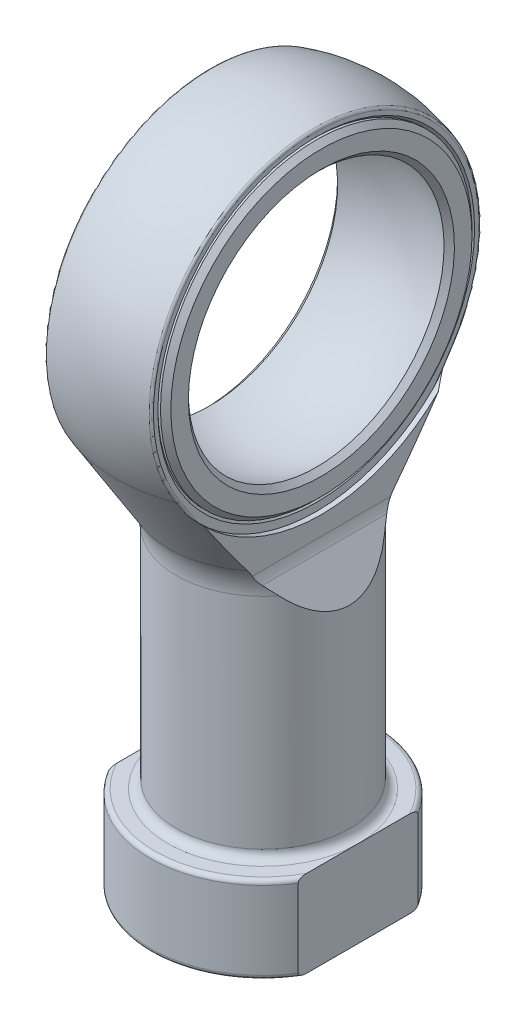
SolidWorks part; units mm, degrees
ref_plane "Plan de face" through (0, 0, 0) normal (0, 0, 1) x (1, 0, 0)
ref_plane "Plan de dessus" through (0, 0, 0) normal (0, 1, 0) x (1, 0, 0)
ref_plane "Plan de droite" through (0, 0, 0) normal (1, 0, 0) x (0, 0, -1)
sketch "Esquisse6" plane through (0, 0, 0) normal (0, 0, 1) x (1, 0, 0)
  line L0 (0, 0) -> (7.0324, 0) construction
  line L1 (-3.075, 9) -> (3.075, 9)
  line L2 (-3.375, 8.7) -> (-3.375, 7.6854)
  line L3 (-3.075, 9) -> (-3.375, 8.7)
  line L4 (3.375, 8.7) -> (3.375, 7.6854)
  line L5 (3.075, 9) -> (3.375, 8.7)
  line L6 (3.375, 7.6854) -> (3.075, 7.3854)
  line L7 (-3.075, 7.3854) -> (-3.375, 7.6854)
  arc A1 (3.075, 7.3854) -> (-3.075, 7.3854) centre (0, 0) ccw
  point P1 (0, 8)
  point P7 (-3.375, 9)
  point P13 (3.375, 9)
  dimension "D1" = 8
  dimension "D2" = 6.75
  dimension "D3" = 9
revolve "Révolution3" add sketch "Esquisse6" angle 360 about L0
sketch "Esquisse2" plane through (0, 0, 0) normal (0, 0, 1) x (1, 0, 0)
  line L0 (0, 10) -> (0, 5)
  line L5 (-5, -11.8435) -> (-5, -24.5)
  line L6 (-5.5, -25) -> (-6.25, -25)
  line L7 (-6.5, -25.25) -> (-6.5, -29.75)
  line L8 (-6.25, -30) -> (-3, -30)
  line L9 (0, -5) -> (0, -13.2679)
  line L10 (-8.5346, -5.2115) -> (-5.4396, -10.2801)
  line L11 (-3, -30) -> (-3, -15)
  line L12 (-3, -15) -> (0, -13.2679)
  arc A0 (-5, -24.5) -> (-5.5, -25) centre (-5.5, -24.5) cw
  arc A1 (0, 10) -> (-8.5346, -5.2115) centre (0, 0) ccw
  arc A2 (-6.5, -29.75) -> (-6.25, -30) centre (-6.25, -29.75) ccw
  arc A3 (-6.25, -25) -> (-6.5, -25.25) centre (-6.25, -25.25) ccw
  arc A4 (-5, -11.8435) -> (-5.4396, -10.2801) centre (-8, -11.8435) ccw
  arc A8 (0, 5) -> (0, -5) centre (0, 0) ccw
  point P7 (-6.5, -30)
  point P17 (-6.5, -25)
  point P20 (-5, -11)
  dimension "D1" = 20
  dimension "D10" = 0.5
  dimension "D11" = 0.25
  dimension "D12" = 3
  dimension "D16" = 5
  dimension "D7" = 15
  dimension "D2" = 11
  dimension "D3" = 5
  dimension "D4" = 6.5
  dimension "D5" = 5
  dimension "D6" = 30
  dimension "D8" = 120
  dimension "D9" = 3
revolve "Révolution2" add sketch "Esquisse2" angle 360 about L0
sketch "Esquisse3" plane through (0, 0, 0) normal (0, 0, 1) x (1, 0, 0)
  line L0 (-3.375, 21.1469) -> (-3.375, -10.6847)
  line L1 (-3.5558, -11.2583) -> (-5.5, -14.0348)
  line L2 (-5.5, -14.0348) -> (-5.5, -47.713)
  line L3 (-5.5, -47.713) -> (-20.4695, -48.711)
  line L4 (-20.4695, -48.711) -> (-20.4695, 21.1469)
  line L5 (-20.4695, 21.1469) -> (-3.375, 21.1469)
  line L6 (0, 0) -> (0, 23.9861) construction
  line L7 (20.4695, 21.1469) -> (3.375, 21.1469)
  line L8 (20.4695, -48.711) -> (20.4695, 21.1469)
  line L9 (5.5, -47.713) -> (20.4695, -48.711)
  line L10 (5.5, -14.0348) -> (5.5, -47.713)
  line L11 (3.5558, -11.2583) -> (5.5, -14.0348)
  line L12 (3.375, 21.1469) -> (3.375, -10.6847)
  arc A0 (-3.375, -10.6847) -> (-3.5558, -11.2583) centre (-4.375, -10.6847) cw
  arc A1 (3.375, -10.6847) -> (3.5558, -11.2583) centre (4.375, -10.6847) ccw
  point P9 (-3.375, -11)
  dimension "D5" = 1
  dimension "D1" = 5.5
  dimension "D2" = 35
  dimension "D3" = 3.375
  dimension "D4" = 11
extrude "Enlèv. mat.-Extru.1" cut sketch "Esquisse3" against normal mid plane 50
sketch "Esquisse7" plane through (-3.375, 0, 0) normal (-1, 0, 0) x (0, 0, 1)
  circle A1 centre (0, 0) radius 9 construction
  circle A2 centre (0, 0) radius 9
extrude "Enlèv. mat.-Extru.3" cut sketch "Esquisse7" against normal blind 50
sketch "Esquisse8" plane through (-3.375, 0, 0) normal (-1, 0, 0) x (0, 0, 1)
  arc A4 (9.6, 0) -> (9.6, 0) centre (0, 0) ccw
  circle A5 centre (0, 0) radius 9.6
  dimension "D1" = 0.6
extrude "Enlèv. mat.-Extru.4" cut sketch "Esquisse8" against normal blind 0.3
sketch "Esquisse9" plane through (3.375, 0, 0) normal (1, 0, 0) x (0, 0, -1)
  circle A1 centre (0, 0) radius 9.6 construction
  circle A2 centre (0, 0) radius 9.6
extrude "Enlèv. mat.-Extru.5" cut sketch "Esquisse9" against normal blind 0.3
chamfer "Chanfrein1" distance 0.15 angle 45 2 edges at (3.075, 9, 0) (-3.075, -9, 0)
fillet "Congé2" radius 0.15 6 edges at (-3.075, 9.5155, 0) (3.075, 9.5155, 0)
